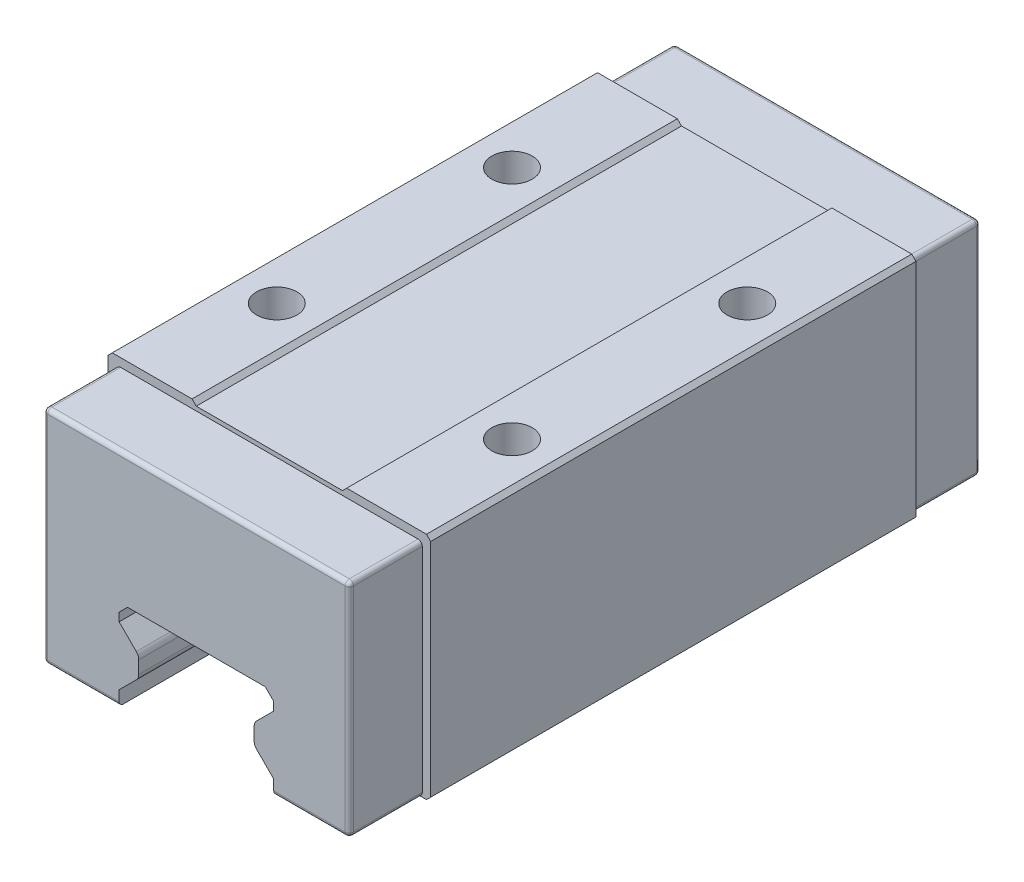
SolidWorks part; units mm, degrees
ref_plane "Front Plane" through (0, 0, 0) normal (0, 0, 1) x (1, 0, 0)
ref_plane "Top Plane" through (0, 0, 0) normal (0, 1, 0) x (1, 0, 0)
ref_plane "Right Plane" through (0, 0, 0) normal (1, 0, 0) x (0, 0, -1)
sketch "Sketch1" plane through (0, 0, 0) normal (0, 0, 1) x (1, 0, 0)
  line L1 (-24, 5.8) -> (24, 5.8)
  line L2 (-24, 5.8) -> (-24, 40)
  line L3 (-24, 40) -> (24, 40)
  line L4 (24, 5.8) -> (24, 40)
  line L5 (-24, 5.8) -> (24, 40) construction
  line L6 (-24, 40) -> (24, 5.8) construction
  point P0 (0, 22.9)
  dimension "D1" = 40
  dimension "D2" = 5.8
  dimension "D3" = 48
extrude "Boss-Extrude1" add sketch "Sketch1" along normal mid plane 72.2
sketch "Sketch2" plane through (0, 0, 0) normal (0, 0, 1) x (1, 0, 0)
  line L0 (-24, 5.8) -> (24, 5.8) construction
  line L1 (-22.75, 5.8) -> (22.75, 5.8)
  line L2 (-22.75, 5.8) -> (-22.75, 38.75)
  line L3 (-22.75, 38.75) -> (22.75, 38.75)
  line L4 (22.75, 5.8) -> (22.75, 38.75)
  line L5 (-22.75, 38.75) -> (-24, 38.75) construction
  line L6 (-24, 40) -> (-24, 5.8) construction
  line L7 (22.75, 38.75) -> (22.75, 40) construction
  line L8 (24, 40) -> (-24, 40) construction
  line L9 (22.75, 38.75) -> (24, 38.75) construction
  line L10 (24, 5.8) -> (24, 40) construction
  point P9 (0, 38.75)
  dimension "D1" = 1.25
extrude "Boss-Extrude2" add sketch "Sketch2" along normal mid plane 93.9
sketch "Sketch3" plane through (0, 0, 46.95) normal (0, 0, 1) x (1, 0, 0)
  line L1 (-11.5, 19.2) -> (11.5, 19.2)
  line L2 (-11.5, 19.2) -> (-11.5, 0)
  line L3 (-11.5, 0) -> (11.5, 0)
  line L4 (11.5, 19.2) -> (11.5, 0)
  line L5 (-11.5, 19.2) -> (11.5, 0) construction
  line L6 (-11.5, 0) -> (11.5, 19.2) construction
  point P0 (0, 9.6)
  dimension "D1" = 23
  dimension "D2" = 19.2
extrude "Cut-Extrude1" cut sketch "Sketch3" against normal through all
sketch "Sketch4" plane through (0, 0, 46.95) normal (0, 0, 1) x (1, 0, 0)
  line L0 (-11.5, 16.7) -> (-11.5, 7.95)
  line L1 (-11.5, 19.2) -> (-11.5, 5.8) construction
  line L2 (-11.5, 7.95) -> (-8.5833, 10.8667)
  line L3 (-8.5833, 10.8667) -> (-8.5833, 13.7833)
  line L4 (-8.5833, 13.7833) -> (-11.5, 16.7)
  line L5 (11.5, 19.2) -> (-11.5, 19.2) construction
  line L6 (-8.5833, 13.7833) -> (-11.5, 13.7833) construction
  line L7 (-8.5833, 10.8667) -> (-11.5, 10.8667) construction
  line L8 (-10.0417, 13.7833) -> (-10.0417, 10.8667) construction
  line L9 (0, 0) -> (0, 19.2) construction
  line L10 (10.0417, 13.7833) -> (10.0417, 10.8667) construction
  line L11 (8.5833, 10.8667) -> (11.5, 10.8667) construction
  line L12 (8.5833, 13.7833) -> (11.5, 13.7833) construction
  line L13 (8.5833, 13.7833) -> (11.5, 16.7)
  line L14 (8.5833, 10.8667) -> (8.5833, 13.7833)
  line L15 (11.5, 7.95) -> (8.5833, 10.8667)
  line L16 (11.5, 16.7) -> (11.5, 7.95)
extrude "Boss-Extrude3" add sketch "Sketch4" against normal up to surface (93.9 mm away)
chamfer "Chamfer1" distance 1.25 angle 45 2 edges at (11.5, 19.2, 0) (-11.5, 19.2, 0)
fillet "Fillet1" radius 1.25 4 edges at (8.5833, 10.8667, 0) (8.5833, 13.7833, 0) (-8.5833, 10.8667, 0) (-8.5833, 13.7833, 0)
sketch "Sketch5" plane through (0, 0, 36.1) normal (0, 0, 1) x (1, 0, 0)
  line L0 (24, 40) -> (-24, 40) construction
  line L1 (-11.5, 40) -> (11.5, 40)
  line L2 (-11.5, 40) -> (-11.5, 39.375)
  line L3 (-11.5, 39.375) -> (11.5, 39.375)
  line L4 (11.5, 40) -> (11.5, 39.375)
  point P6 (0, 39.375)
  dimension "D1" = 23
  dimension "D2" = 0.625
extrude "Cut-Extrude2" cut sketch "Sketch5" against normal through all
chamfer "Chamfer2" distance 0.625 angle 45 6 edges at (24, 40, 0) (24, 5.8, 0) (-24, 5.8, 0) (-24, 40, 0) (11.5, 39.375, 0) (-11.5, 39.375, 0)
fillet "Fillet2" radius 0.625 18 edges at (-22.75, 5.8, -41.525) (17.125, 5.8, -46.95) (-22.75, 5.8, 41.525) (-17.125, 5.8, -46.95) (-17.125, 5.8, 46.95) (17.125, 5.8, 46.95) (22.75, 5.8, 41.525) (-22.75, 22.275, 46.95) (-22.75, 22.275, -46.95) (-22.75, 38.75, 41.525) (22.75, 38.75, 41.525) (22.75, 22.275, 46.95) (22.75, 22.275, -46.95) (0, 38.75, 46.95) (0, 38.75, -46.95) (22.75, 5.8, -41.525) (22.75, 38.75, -41.525) (-22.75, 38.75, -41.525)
sketch "Sketch6" plane through (0, 40, 0) normal (0, 1, 0) x (1, 0, 0)
  line L0 (-17.5, 17.5) -> (0, 0) construction
  line L1 (0, 0) -> (17.5, -17.5) construction
  line L2 (17.5, 17.5) -> (0, 0) construction
  line L3 (0, 0) -> (-17.5, -17.5) construction
  circle A0 centre (-17.5, 17.5) radius 3
  circle A1 centre (-17.5, -17.5) radius 3
  circle A2 centre (17.5, -17.5) radius 3
  circle A3 centre (17.5, 17.5) radius 3
  dimension "D1" = 6
  dimension "D2" = 35
  dimension "D3" = 35
extrude "Cut-Extrude3" cut sketch "Sketch6" against normal blind 9
sketch "Sketch7" plane through (0, 0, 0) normal (0, 0, 1) x (1, 0, 0)
  line L0 (-23.375, 40) -> (-35, 40)
  line L1 (-35, 40) -> (-35, 30)
  line L2 (-23.375, 40) -> (-23.375, 19.625)
  line L3 (-24, 39.375) -> (-24, 6.425) construction
  line L4 (-24, 19.625) -> (-23.375, 19.625)
  line L5 (-35, 30) -> (-34.375, 30)
  line L6 (0, 0) -> (0, 39.375) construction
  line L7 (-10.875, 39.375) -> (10.875, 39.375) construction
  line L8 (35, 30) -> (34.375, 30)
  line L9 (24, 19.625) -> (23.375, 19.625)
  line L10 (23.375, 40) -> (23.375, 19.625)
  line L11 (35, 40) -> (35, 30)
  line L12 (23.375, 40) -> (35, 40)
  arc A1 (-34.375, 30) -> (-24, 19.625) centre (-34.375, 19.625) cw
  arc A2 (34.375, 30) -> (24, 19.625) centre (34.375, 19.625) ccw
  point P22 (-34.6875, 30)
  dimension "D1" = 70
  dimension "D2" = 10
  dimension "D3" = 0.625
extrude "Boss-Extrude4" [suppressed] add sketch "Sketch7" along normal mid plane 30
sketch "Sketch8" [suppressed] plane through (0, 0, 0) normal (0, 0, 1) x (1, 0, 0)
  line L5 (-35, 30) -> (-35, 40)
  line L6 (-35, 30) -> (-23.38, 30)
  line L7 (-35, 40) -> (-23.38, 40)
  line L8 (-23.38, 30) -> (-23.38, 40)
  line L9 (35, 30) -> (35, 40)
  line L10 (35, 30) -> (23.38, 30)
  line L11 (35, 40) -> (23.38, 40)
  line L13 (23.38, 40) -> (23.38, 30)
extrude "Boss-Extrude5" [suppressed] add sketch "Sketch8" along normal mid plane 72.2
chamfer "Chamfer3" [suppressed] distance 0.625 angle 45
fillet "Fillet3" [suppressed] radius 6
equation "\"D2@Sketch4\"=\"D1@Sketch4\"*3.5"
